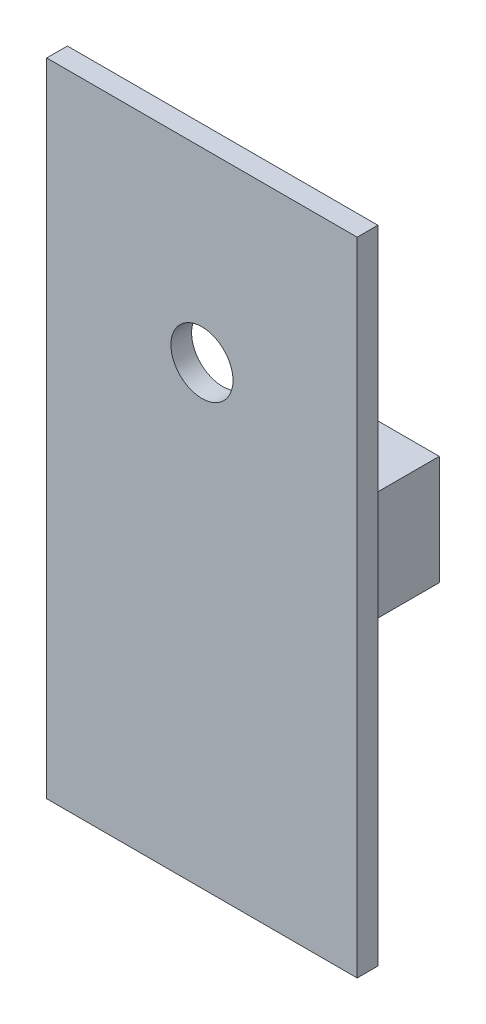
SolidWorks part; units mm, degrees
ref_plane "Front Plane" through (0, 0, 0) normal (0, 0, 1) x (1, 0, 0)
ref_plane "Top Plane" through (0, 0, 0) normal (0, 1, 0) x (1, 0, 0)
ref_plane "Right Plane" through (0, 0, 0) normal (1, 0, 0) x (0, 0, -1)
sketch "Sketch1" plane through (0, 0, 0) normal (0, 0, 1) x (1, 0, 0)
  line L1 (-8.0161, 4.5757) -> (6.9839, 4.5757)
  line L2 (-8.0161, 4.5757) -> (-8.0161, -26.4243)
  line L3 (-8.0161, -26.4243) -> (6.9839, -26.4243)
  line L4 (6.9839, 4.5757) -> (6.9839, -26.4243)
  circle A0 centre (-0.5161, -4.4243) radius 1.5
  dimension "D3" = 3
  dimension "D1" = 15
  dimension "D2" = 31
  dimension "D4" = 9
  dimension "D5" = 7.5
extrude "Boss-Extrude1" add sketch "Sketch1" along normal blind 1
sketch "Sketch2" plane through (0, 0, 0) normal (0, 0, -1) x (-1, 0, 0)
  line L1 (-5.9519, -7.6113) -> (-1.0861, -7.6113)
  line L2 (-5.9519, -7.6113) -> (-5.9519, -12.8971)
  line L3 (-5.9519, -12.8971) -> (-1.0861, -12.8971)
  line L4 (-1.0861, -7.6113) -> (-1.0861, -12.8971)
extrude "Boss-Extrude2" add sketch "Sketch2" along normal blind 4
